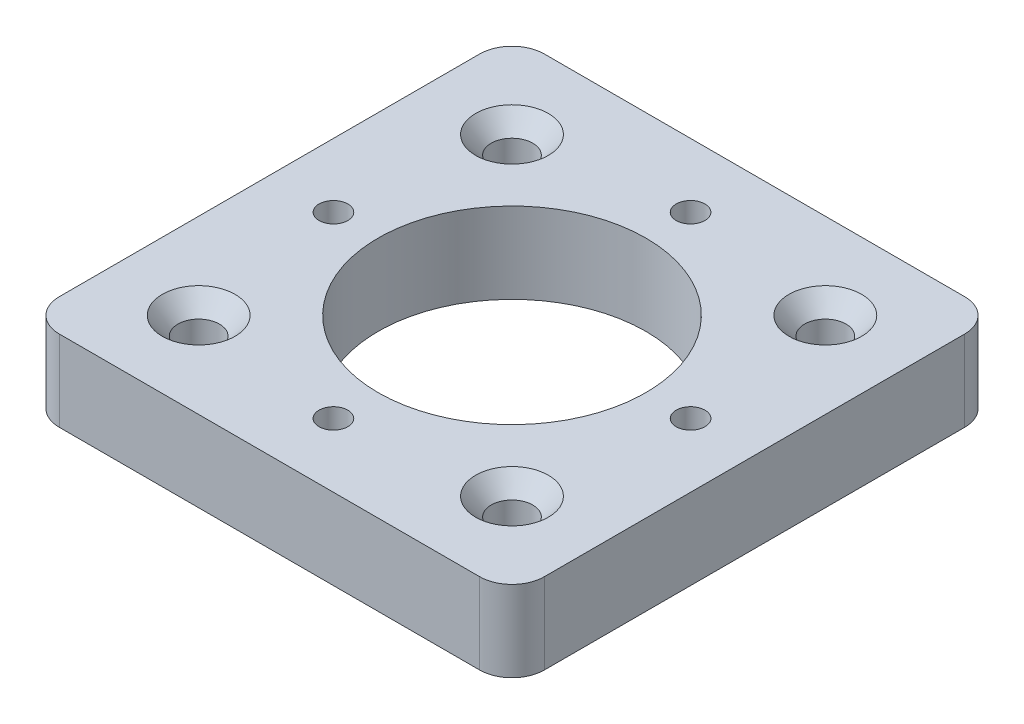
SolidWorks part; units mm, degrees
ref_plane "Front Plane" through (0, 0, 0) normal (0, 0, 1) x (1, 0, 0)
ref_plane "Top Plane" through (0, 0, 0) normal (0, 1, 0) x (1, 0, 0)
ref_plane "Right Plane" through (0, 0, 0) normal (1, 0, 0) x (0, 0, -1)
sketch "Sketch1" plane through (0, 0, 0) normal (0, 1, 0) x (1, 0, 0)
  line L1 (-19.05, 19.05) -> (19.05, 19.05)
  line L2 (-19.05, 19.05) -> (-19.05, -19.05)
  line L3 (-19.05, -19.05) -> (19.05, -19.05)
  line L4 (19.05, 19.05) -> (19.05, -19.05)
  line L5 (-19.05, 19.05) -> (19.05, -19.05) construction
  line L6 (-19.05, -19.05) -> (19.05, 19.05) construction
  point P0 (0, 0)
  dimension "D1" = 38.1
  dimension "D2" = 38.1
extrude "Boss-Extrude1" add sketch "Sketch1" along normal blind 6.35
sketch "Sketch2" plane through (0, 6.35, 0) normal (0, 1, 0) x (1, 0, 0)
  circle A0 centre (0, 0) radius 10.5169
  dimension "D1" = 21.0337
extrude "Cut-Extrude1" cut sketch "Sketch2" against normal through all
sketch "Sketch3" plane through (0, 6.35, 0) normal (0, 1, 0) x (1, 0, 0)
  line L0 (0, 19.05) -> (0, -19.05) construction
  line L1 (19.05, 19.05) -> (-19.05, 19.05) construction
  line L2 (-19.05, -19.05) -> (19.05, -19.05) construction
  line L3 (-19.05, 0) -> (19.05, 0) construction
  line L4 (-19.05, 19.05) -> (-19.05, -19.05) construction
  line L5 (19.05, -19.05) -> (19.05, 19.05) construction
hole_wizard "CSK for #4 Flat Head Machine Screw1" positions "Sketch4" profile "Sketch5" countersink size "#4" standard "ANSI Inch"
sketch "Sketch4" plane through (0, 6.35, 0) normal (0, 1, 0) x (1, 0, 0)
  line L0 (-19.05, 0) -> (19.05, 0) construction
  line L1 (0, 19.05) -> (0, -19.05) construction
  point P0 (-12.3063, 12.3063)
  point P22 (12.3063, 12.3063)
  point P23 (12.3063, -12.3063)
  point P24 (-12.3063, -12.3063)
  point P25 (0, 0)
  dimension "D1" = 12.3063
  dimension "D2" = 12.3063
  dimension "D3" = 4
sketch "Sketch5" plane through (-12.3063, 6.35, -12.3063) normal (1, 0, 0) x (0, 0, 1)
  line L0 (0, 0) -> (0, 6.35)
  line L1 (0, 6.35) -> (1.6319, 6.35)
  line L2 (1.6319, 6.35) -> (1.6319, 1.4098)
  line L3 (1.6319, 1.4098) -> (2.8575, 0)
  line L5 (2.8575, 0) -> (0, 0)
  line L6 (-1.6319, 1.4098) -> (-2.8575, 0) construction
  line L11 (0, -6.35) -> (0, 107.95) construction
  dimension "Thru Hole Dia." = 3.2639
  dimension "Thru Hole Depth" = 6.35
  dimension "Near C'Sink Dia." = 5.715
  dimension "Near C'Sink Angle" = 82
hole_wizard "#4-40 Tapped Hole1" positions "Sketch6" profile "Sketch7" tap size "#4-40" standard "ANSI Inch"
sketch "Sketch6" plane through (0, 6.35, 0) normal (0, 1, 0) x (1, 0, 0)
  line L5 (-12.3063, -12.3063) -> (12.3063, 12.3063) construction
  line L6 (-12.3063, 12.3063) -> (12.3063, -12.3063) construction
  point P0 (0, 14.0272)
  point P30 (14.0272, 0)
  point P31 (0, -14.0272)
  point P32 (-14.0272, 0)
  point P33 (0, 0)
  point P34 (0, 0)
  point P35 (0, 0)
  point P36 (0, 0)
  point P37 (0, 0)
  point P38 (0, 0)
  point P39 (0, 0)
  point P40 (0, 0)
  dimension "D1" = 9.9187
  dimension "D2" = 9.9187
  dimension "D3" = 4
sketch "Sketch7" plane through (0, 6.35, -14.0272) normal (1, 0, 0) x (0, 0, 1)
  line L0 (0, 0) -> (0, 6.35)
  line L1 (0, 6.35) -> (1.1303, 6.35)
  line L2 (1.1303, 6.35) -> (1.1303, 0)
  line L5 (1.1303, 0) -> (0, 0)
  line L11 (0, -6.35) -> (0, 107.95) construction
  dimension "Thru Tap Drill Dia." = 2.2606
  dimension "Thru Tap Drill Depth" = 6.35
fillet "Fillet1" radius 2.54 4 edges at (-19.05, 3.175, 19.05) (19.05, 3.175, 19.05) (19.05, 3.175, -19.05) (-19.05, 3.175, -19.05)
